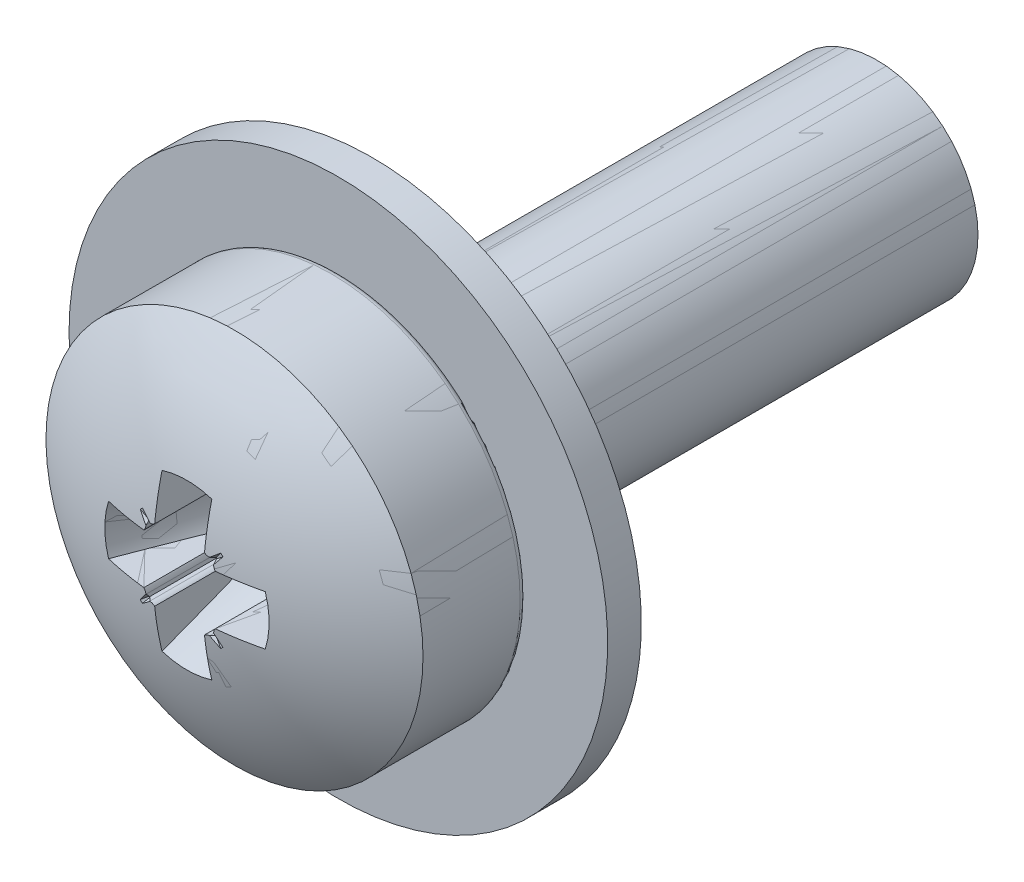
SolidWorks part; units mm, degrees
ref_plane "Face" through (0, 0, 0) normal (0, 0, 1) x (1, 0, 0)
ref_plane "Dessus" through (0, 0, 0) normal (0, 1, 0) x (1, 0, 0)
ref_plane "Droite" through (0, 0, 0) normal (1, 0, 0) x (0, 0, -1)
imported_body "Importée1"
sketch "Esquisse1" plane through (0, 0, 0) normal (0, 0, -1) x (-1, 0, 0)
  circle A1 centre (0, 0) radius 1.5 construction
  circle A2 centre (0, 0) radius 4
  circle A3 centre (0, 0) radius 1.5
  dimension "D1" = 8
extrude "Boss.-Extru.1" add sketch "Esquisse1" along normal blind 0.5
